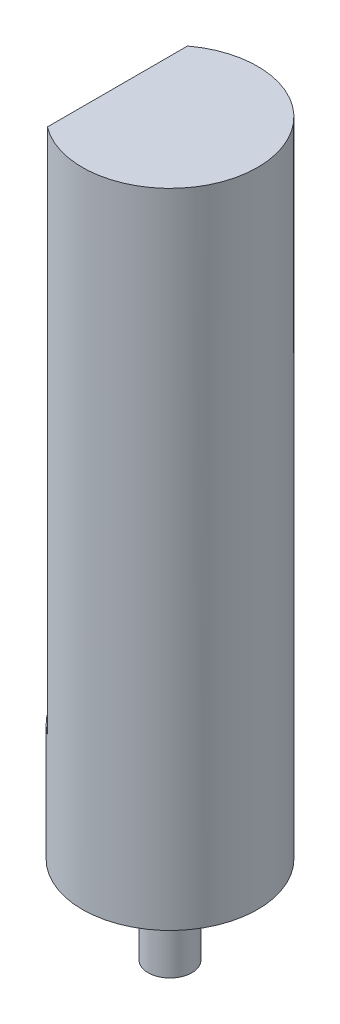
SolidWorks part; units mm, degrees
ref_plane "Спереди" through (0, 0, 0) normal (0, 0, 1) x (1, 0, 0)
ref_plane "Сверху" through (0, 0, 0) normal (0, 1, 0) x (1, 0, 0)
ref_plane "Справа" through (0, 0, 0) normal (1, 0, 0) x (0, 0, -1)
sketch "Эскиз1" plane through (0, 0, 0) normal (0, 1, 0) x (1, 0, 0)
  circle A0 centre (0, 0) radius 1.5
  dimension "D1" = 3
extrude "Бобышка-Вытянуть1" add sketch "Эскиз1" along normal blind 11
sketch "Эскиз2" plane through (0, 11, 0) normal (0, 1, 0) x (1, 0, 0)
  line L0 (-0.9, -1.2) -> (-0.9, 1.2)
  line L1 (-1.5, 0) -> (1.5, 0) construction
  circle A1 centre (0, 0) radius 1.5
  arc A2 (-0.9, 1.2) -> (-0.9, -1.2) centre (0, 0) ccw
  dimension "D2" = 2.4
  dimension "D1" = 0
extrude "Вырез-Вытянуть1" cut sketch "Эскиз2" against normal blind 9
sketch "Эскиз3" plane through (0, 0, 0) normal (0, -1, 0) x (1, 0, 0)
  circle A0 centre (0, 0) radius 0.375
  dimension "D1" = 0.75
extrude "Бобышка-Вытянуть2" add sketch "Эскиз3" along normal blind 1.5
